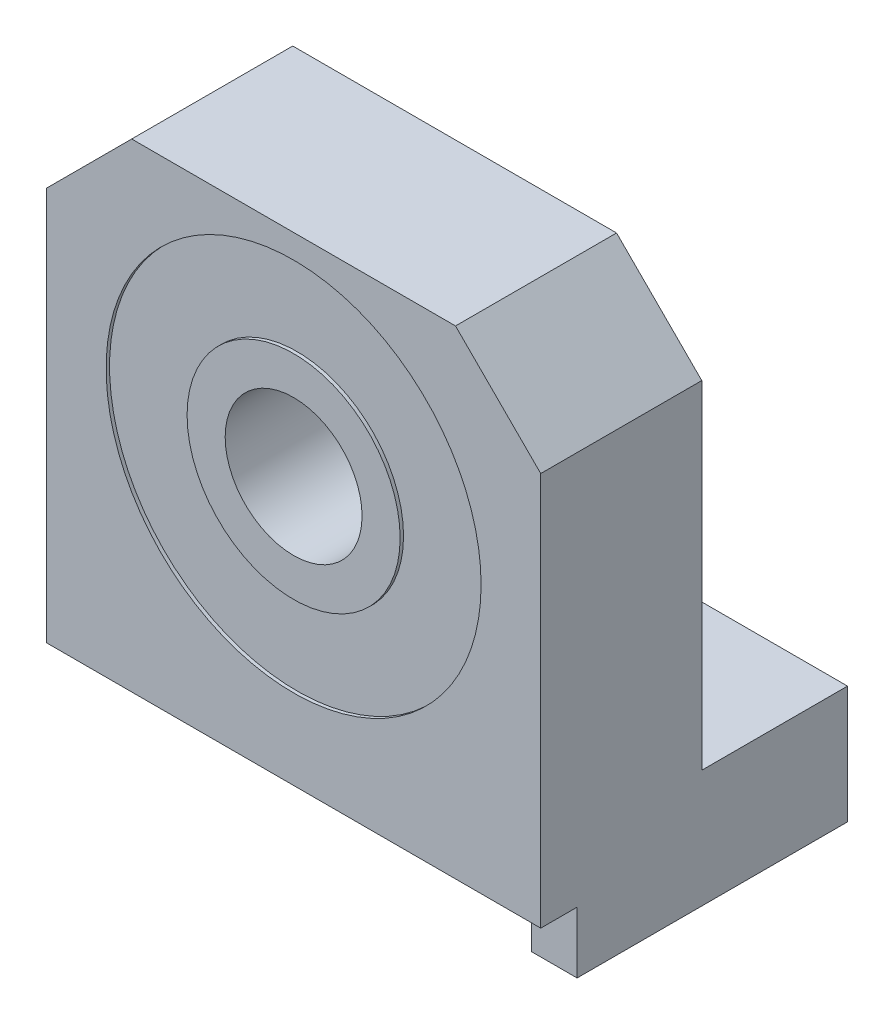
SolidWorks part; units mm, degrees
ref_plane "Front" through (0, 0, 0) normal (0, 0, 1) x (1, 0, 0)
ref_plane "Top" through (0, 0, 0) normal (0, 1, 0) x (1, 0, 0)
ref_plane "Right" through (0, 0, 0) normal (1, 0, 0) x (0, 0, -1)
sketch "Sketch1" plane through (0, 0, 0) normal (0, 0, 1) x (1, 0, 0)
  line L1 (-18.415, 17.399) -> (18.415, 17.399)
  line L2 (-18.415, 17.399) -> (-18.415, -22.479)
  line L3 (-18.415, -22.479) -> (18.415, -22.479)
  line L4 (18.415, 17.399) -> (18.415, -22.479)
  point P4 (0, -22.479)
  dimension "D1" = 36.83
  dimension "D2" = 39.878
  dimension "D3" = 22.479
extrude "Extrude1" add sketch "Sketch1" along normal blind 12
sketch "Sketch7" plane through (0, 0, 0) normal (0, 0, -1) x (-1, 0, 0)
  circle A0 centre (14.605, 6.858) radius 2.4257
  dimension "D1" = 6.858
  dimension "D3" = 4.8514
  dimension "D2" = 14.605
extrude "Cut-Extrude1" cut sketch "Sketch7" against normal through all
sketch "Sketch8" plane through (0, 0, 0) normal (0, 0, -1) x (-1, 0, 0)
  circle A0 centre (-1.9685, -3.0644) radius 10.795
  dimension "D1" = 1.9685
  dimension "D3" = 21.59
  dimension "D2" = 3.0644
extrude "Extrude3" add sketch "Sketch8" against normal offset from surface (13.524 mm away) 1.524
sketch "Sketch11" plane through (0, 0, 12) normal (0, 0, 1) x (1, 0, 0)
  circle A0 centre (18.415, 17.399) radius 9.525
  dimension "D1" = 19.05
extrude "Cut-Extrude2" [suppressed] cut sketch "Sketch11" against normal through all
chamfer "Chamfer1" [suppressed] distance 2.032 angle 45
sketch "Sketch12" plane through (0, 0, 13.524) normal (0, 0, 1) x (1, 0, 0)
  circle A0 centre (0, 0) radius 4.3688
  dimension "D1" = 8.7376
extrude "Cut-Extrude3" cut sketch "Sketch12" against normal through all
sketch "Sketch13" plane through (0, 0, 12) normal (0, 0, 1) x (1, 0, 0)
  line L0 (18.415, -22.479) -> (18.415, 17.399) construction
  line L1 (-18.415, -22.479) -> (18.415, -22.479)
  line L2 (-18.415, -22.479) -> (-18.415, -15.748)
  line L3 (-18.415, -15.748) -> (18.415, -15.748)
  line L4 (18.415, -22.479) -> (18.415, -15.748)
  dimension "D1" = 6.731
extrude "Extrude4" add sketch "Sketch13" against normal blind 22.86
sketch "Sketch14" plane through (0, 0, 0) normal (0, 0, -1) x (-1, 0, 0)
  circle A0 centre (0, 0) radius 7
  dimension "D1" = 14
extrude "Cut-Extrude4" [suppressed] cut sketch "Sketch14" against normal blind 9.5
sketch "Sketch15" plane through (0, -22.479, 0) normal (0, -1, 0) x (1, 0, 0)
  line L0 (-18.415, 12) -> (18.415, 12) construction
  line L1 (18.415, -10.86) -> (15, -10.86)
  line L2 (18.415, -10.86) -> (18.415, 12)
  line L3 (18.415, 12) -> (15, 12)
  line L4 (15, -10.86) -> (15, 12)
  line L6 (-18.415, -10.86) -> (-15, -10.86)
  line L7 (-18.415, -10.86) -> (-18.415, 12)
  line L8 (-18.415, 12) -> (-15, 12)
  line L9 (-15, -10.86) -> (-15, 12)
  dimension "D1" = 3.415
  dimension "D2" = 3.415
extrude "Extrude5" add sketch "Sketch15" along normal blind 2.032
sketch "Sketch17" plane through (0, 0, 0) normal (0, 0, -1) x (-1, 0, 0)
  line L0 (-18.415, -15.748) -> (-18.415, 17.399) construction
  line L1 (18.415, 17.399) -> (-18.415, 17.399)
  line L2 (18.415, 17.399) -> (18.415, 4.699)
  line L3 (18.415, 4.699) -> (-18.415, 4.699)
  line L4 (-18.415, 17.399) -> (-18.415, 4.699)
  dimension "D1" = 12.7
extrude "Cut-Extrude6" [suppressed] cut sketch "Sketch17" against normal blind 3.175
sketch "Sketch18" plane through (0, -24.511, 0) normal (0, -1, 0) x (1, 0, 0)
  line L0 (-18.415, 12) -> (-18.415, -10.86) construction
  line L1 (-15, -10.86) -> (15, -10.86) construction
  circle A0 centre (-10.5, -3.96) radius 1.5494
  dimension "D1" = 3.0988
  dimension "D2" = 7.915
  dimension "D3" = 6.9
extrude "Cut-Extrude7" cut sketch "Sketch18" against normal through all
mirror "Mirror2" about plane through (0, 0, 0) normal (1, 0, 0) of "Cut-Extrude7"
sketch "Sketch23" plane through (0, 17.399, 0) normal (0, 1, 0) x (-1, 0, 0)
  line L1 (-18.415, 12) -> (18.415, 12)
  line L2 (-18.415, 12) -> (-18.415, 0)
  line L3 (-18.415, 0) -> (18.415, 0)
  line L4 (18.415, 12) -> (18.415, 0)
extrude "Cut-Extrude10" cut sketch "Sketch23" against normal blind 1.651
chamfer "Chamfer2" distance 6.35 angle 45 2 edges at (18.415, 15.748, 6) (-18.415, 15.748, 6)
sketch "Sketch19" plane through (-15, 0, 0) normal (1, 0, 0) x (0, 0, -1)
  line L1 (10.86, -22.479) -> (-12, -22.479)
  line L2 (10.86, -22.479) -> (10.86, -24.511)
  line L3 (10.86, -24.511) -> (-12, -24.511)
  line L4 (-12, -22.479) -> (-12, -24.511)
extrude "Cut-Extrude8" cut sketch "Sketch19" against normal through all
hole_wizard "M12x1.00 SPECIAL" positions "Sketch21" profile "Sketch20" tap size "M12x1.75" standard "Ansi Metric"
sketch "Sketch21" plane through (0, 0, 0) normal (0, 0, -1) x (-1, 0, 0)
  circle A0 centre (0, 0) radius 4.3688 construction
  point P0 (0, 0)
sketch "Sketch20" plane through (0, 0, 0) normal (1, 0, 0) x (0, 1, 0)
  line L0 (0, 0) -> (0, 13.524)
  line L1 (0, 13.524) -> (5.1, 13.524)
  line L2 (5.1, 13.524) -> (5.1, 0)
  line L5 (5.1, 0) -> (0, 0)
  line L11 (0, -6.35) -> (0, 107.95) construction
  dimension "Thru Tap Drill Dia." = 10.2
  dimension "Thru Tap Drill Depth" = 13.524
sketch "Sketch22" plane through (0, 0, 0) normal (1, 0, 0) x (0, 0, -1)
  line L0 (-12, -22.479) -> (10.86, -22.479) construction
  line L1 (-12, -24.511) -> (-9.2898, -24.511)
  line L2 (-12, -24.511) -> (-12, -19.939)
  line L3 (-12, -19.939) -> (-9.2898, -19.939)
  line L4 (-9.2898, -24.511) -> (-9.2898, -19.939)
  dimension "D1" = 2.7102
  dimension "D2" = 2.54
extrude "Cut-Extrude9" cut sketch "Sketch22" against normal through all and the other way through all
sketch "Sketch24" plane through (0, 0, 13.524) normal (0, 0, 1) x (1, 0, 0)
  circle A0 centre (0, 0) radius 7.9375
  dimension "D1" = 15.875
extrude "Extrude8" cut sketch "Sketch24" against normal blind 1.524 flip side to cut
sketch "Sketch25" plane through (0, 0, 12) normal (0, 0, 1) x (1, 0, 0)
  circle A0 centre (-14.605, 6.858) radius 2.4257
extrude "Extrude9" add sketch "Sketch25" against normal up to surface (12 mm away)
sketch "Sketch26" plane through (0, 0, 13.524) normal (0, 0, 1) x (1, 0, 0)
  circle A0 centre (0, 0) radius 5.1
  circle A1 centre (0, 0) radius 13.97
  circle A2 centre (0, 0) radius 5.1 construction
  dimension "D1" = 27.94
extrude "Cut-Extrude11" cut sketch "Sketch26" against normal blind 1.778
sketch "Sketch27" plane through (0, 0, 11.746) normal (0, 0, 1) x (1, 0, 0)
  circle A0 centre (0, 0) radius 7.9375
  circle A1 centre (0, 0) radius 5.1
  circle A2 centre (0, 0) radius 5.1 construction
  dimension "D1" = 15.875
extrude "Boss-Extrude1" add sketch "Sketch27" along normal blind 0.254
